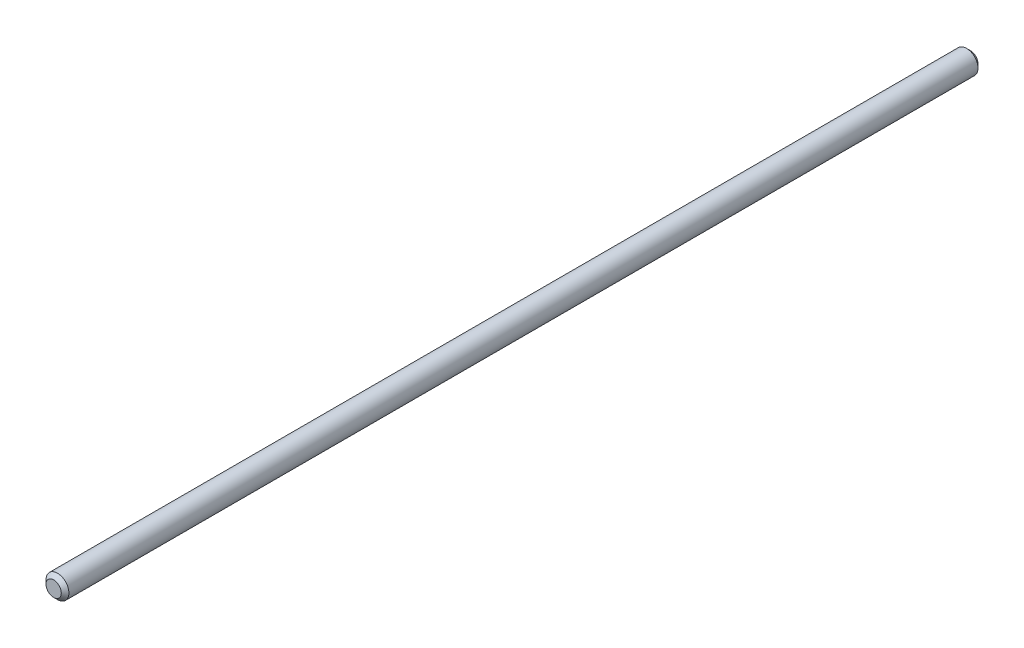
SolidWorks part; units mm, degrees
ref_plane "Plan1" through (0, 0, 0) normal (0, 0, 1) x (1, 0, 0)
ref_plane "Plan2" through (0, 0, 0) normal (0, 1, 0) x (1, 0, 0)
ref_plane "Plan3" through (0, 0, 0) normal (1, 0, 0) x (0, 0, -1)
sketch "Esquisse1" plane through (0, 0, 0) normal (0, 0, 1) x (1, 0, 0)
  circle A0 centre (0, 0) radius 1.5
  dimension "D1" = 3
extrude "Base-Extrusion" add sketch "Esquisse1" along normal blind 120
chamfer "Chanfrein1" distance 0.5 angle 45 2 edges at (1.5, 0, 0) (1.5, 0, 120)
